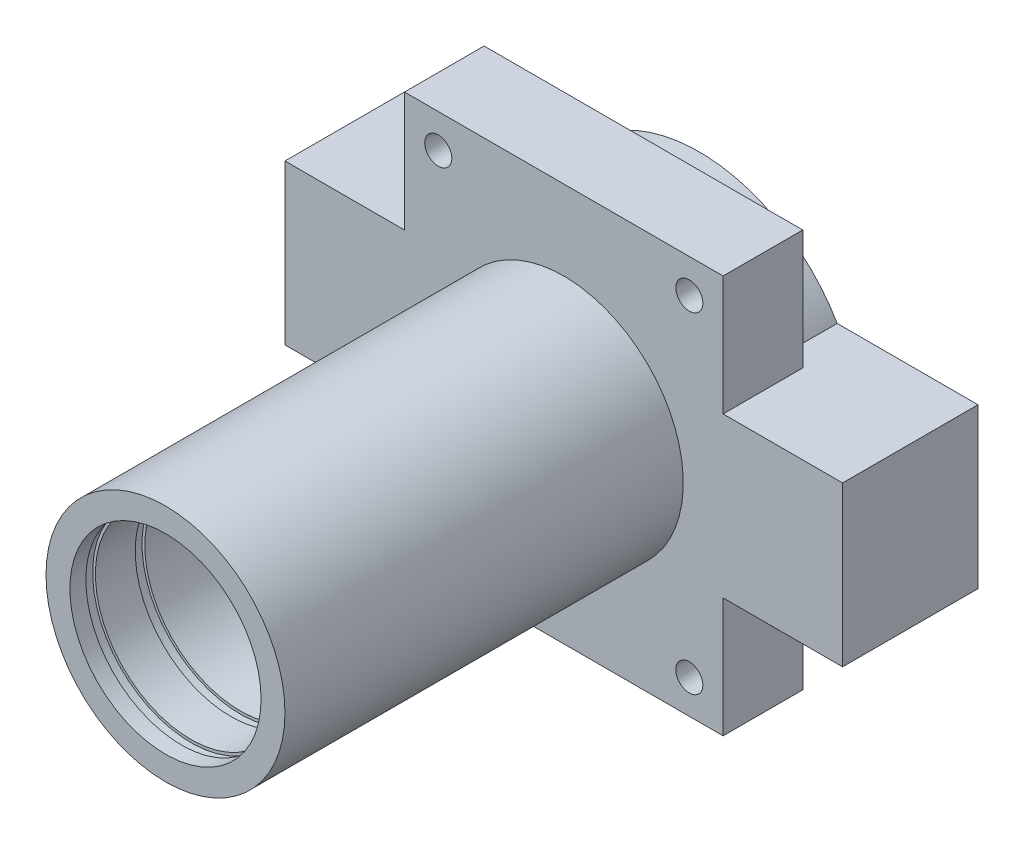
SolidWorks part; units mm, degrees
ref_plane "Front Plane" through (0, 0, 0) normal (0, 0, 1) x (1, 0, 0)
ref_plane "Top Plane" through (0, 0, 0) normal (0, 1, 0) x (1, 0, 0)
ref_plane "Right Plane" through (0, 0, 0) normal (1, 0, 0) x (0, 0, -1)
sketch "Sketch1" plane through (0, 0, 0) normal (0, 0, 1) x (1, 0, 0)
  line L1 (0, 0) -> (40, 0)
  line L2 (0, 0) -> (0, 50)
  line L3 (0, 50) -> (40, 50)
  line L4 (40, 0) -> (40, 50)
  dimension "D1" = 40
  dimension "D2" = 50
extrude "Boss-Extrude1" add sketch "Sketch1" along normal blind 10
sketch "Sketch3" plane through (0, 0, 0) normal (0, 0, -1) x (-1, 0, 0)
  line L0 (0, 25) -> (-40, 25) construction
  line L1 (0, 50) -> (0, 0) construction
  line L2 (-40, 0) -> (-40, 50) construction
  circle A0 centre (-20, 25) radius 7.5
  dimension "D1" = 15
extrude "Cut-Extrude1" cut sketch "Sketch3" against normal blind 10
sketch "Sketch4" plane through (0, 0, 0) normal (0, 0, -1) x (-1, 0, 0)
  circle A1 centre (-20, 25) radius 20
  dimension "D2" = 40
extrude "Boss-Extrude2" add sketch "Sketch4" along normal blind 7
sketch "Sketch5" plane through (0, 0, 0) normal (0, 0, 1) x (1, 0, 0)
  circle A0 centre (20, 25) radius 7.5
  dimension "D1" = 15
sketch "Sketch6" plane through (0, 0, -7) normal (0, 0, -1) x (-1, 0, 0)
  circle A0 centre (-20, 25) radius 18.5
  dimension "D1" = 37
extrude "Cut-Extrude3" cut sketch "Sketch6" against normal blind 9
sketch "Sketch7" plane through (0, 0, 0) normal (-1, 0, 0) x (0, 0, 1)
  line L0 (0, 25) -> (10, 25) construction
  line L1 (10, 50) -> (10, 0) construction
  line L2 (0, 15) -> (0, 35)
  line L3 (0, 50) -> (0, 25) construction
  line L4 (0, 35) -> (10, 35)
  line L5 (10, 35) -> (10, 15)
  line L6 (10, 15) -> (0, 15)
  point P10 (0, 25)
  dimension "D1" = 20
extrude "Boss-Extrude3" add sketch "Sketch7" along normal blind 15
ref_plane "Plane1" through (20, 0, 0) normal (-1, 0, 0) x (0, 0, 1)
mirror "Mirror1" about plane through (20, 0, 0) normal (-1, 0, 0) of "Boss-Extrude3"
sketch "Sketch9" plane through (0, 0, 0) normal (0, 0, -1) x (-1, 0, 0)
  line L0 (15, 15) -> (15, 35)
  line L1 (15, 35) -> (-2.6795, 35)
  line L2 (15, 15) -> (-2.6795, 15)
  circle A0 centre (-20, 25) radius 20 construction
  arc A1 (-2.6795, 15) -> (-2.6795, 35) centre (-20, 25) ccw
extrude "Boss-Extrude4" add sketch "Sketch9" along normal blind 7 contours L2 L1 M5 M6 M7 M13
mirror "Mirror2" about plane through (20, 0, 0) normal (-1, 0, 0) of "Boss-Extrude4"
sketch "Sketch10" plane through (0, 0, 0) normal (0, 0, -1) x (-1, 0, 0)
  line L0 (0, 50) -> (-4.2426, 45.7574) construction
  line L1 (-40, 50) -> (0, 50) construction
  line L2 (-40, 50) -> (-35.7574, 45.7574) construction
  line L3 (0, 0) -> (-4.2426, 4.2426) construction
  line L4 (-40, 0) -> (-35.7574, 4.2426) construction
  line L5 (0, 0) -> (-40, 0) construction
  line L6 (-40, 0) -> (-40, 15) construction
  dimension "D1" = 45
  dimension "D2" = 6
  dimension "D3" = 45
  dimension "D4" = 6
  dimension "D5" = 45
  dimension "D6" = 6
  dimension "D7" = 45
  dimension "D8" = 6
hole_wizard "CSK for M3 Countersunk Flat Head Screw1" positions "3DSketch1" profile "Sketch11" countersink size "M3" standard "ISO"
sketch3d "3DSketch1"
  point P0 (4.2426, 4.2426, 0)
  point P3 (35.7574, 4.2426, 0)
  point P6 (35.7574, 45.7574, 0)
  point P9 (4.2426, 45.7574, 0)
sketch "Sketch11" plane through (4.2426, 4.2426, 0) normal (1, 0, 0) x (0, 1, 0)
  line L0 (0, 0) -> (0, 10)
  line L1 (0, 10) -> (1.7, 10)
  line L2 (1.7, 10) -> (1.7, 1.45)
  line L3 (1.7, 1.45) -> (3.15, 0)
  line L5 (3.15, 0) -> (0, 0)
  line L6 (-1.7, 1.45) -> (-3.15, 0) construction
  line L11 (0, -6.35) -> (0, 107.95) construction
  dimension "Thru Hole Dia." = 3.4
  dimension "Thru Hole Depth" = 10
  dimension "Near C'Sink Dia." = 6.3
  dimension "Near C'Sink Angle" = 90
sketch "Sketch12" plane through (0, 0, -7) normal (0, 0, -1) x (-1, 0, 0)
  line L0 (-55, 25) -> (-47, 25) construction
  line L1 (-55, 15) -> (-55, 35) construction
  line L2 (15, 25) -> (7, 25) construction
  line L3 (15, 15) -> (15, 35) construction
  dimension "D1" = 8
  dimension "D2" = 8
hole_wizard "M5 Clearance Hole1" positions "3DSketch2" profile "Sketch13" hole size "M5" standard "ISO"
sketch3d "3DSketch2"
  point P0 (47, 25, -7)
  point P3 (-7, 25, -7)
sketch "Sketch13" plane through (47, 25, -7) normal (1, 0, 0) x (0, 1, 0)
  line L0 (0, 0) -> (0, 8.6524)
  line L1 (0, 8.6524) -> (2.75, 7)
  line L2 (2.75, 7) -> (2.75, 0)
  line L5 (2.75, 0) -> (0, 0)
  line L10 (0, 8.6524) -> (-2.75, 7) construction
  line L11 (0, -6.35) -> (0, 107.95) construction
  dimension "Hole Dia." = 5.5
  dimension "Hole Depth" = 7
  dimension "Drill Angle" = 118
sketch "Sketch14" plane through (0, 0, 10) normal (0, 0, 1) x (1, 0, 0)
  circle A0 centre (20, 25) radius 15
  circle A1 centre (20, 25) radius 12
  dimension "D1" = 30
  dimension "D2" = 24
extrude "Boss-Extrude5" add sketch "Sketch14" along normal blind 50
ref_plane "Plane2" through (0, 0, 58) normal (0, 0, 1) x (1, 0, 0)
sketch "Sketch15" plane through (0, 0, 58) normal (0, 0, 1) x (1, 0, 0)
  circle A0 centre (20, 25) radius 12.345
  dimension "D1" = 24.69
extrude "Cut-Extrude4" cut sketch "Sketch15" against normal blind 1.2
pattern_linear "LPattern1" count 2 spacing 6.2 along (0, 0, -1) of "Cut-Extrude4"
